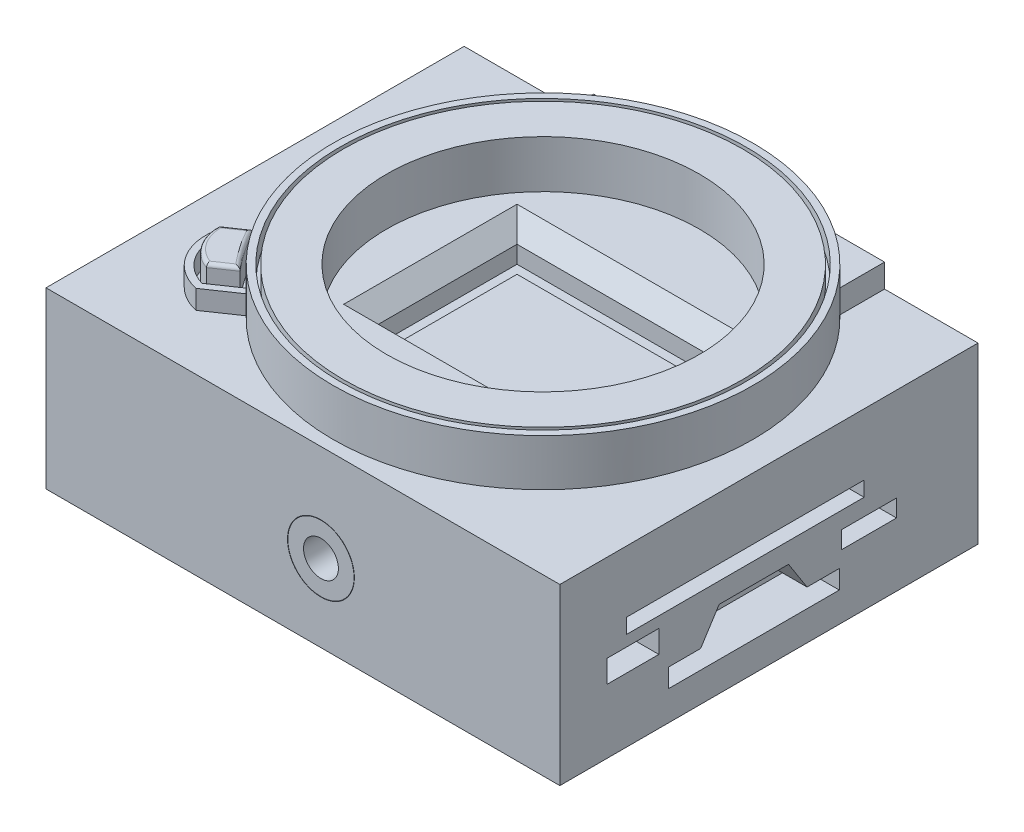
SolidWorks part; units mm, degrees
ref_plane "Front Plane" through (0, 0, 0) normal (0, 0, 1) x (1, 0, 0)
ref_plane "Top Plane" through (0, 0, 0) normal (0, 1, 0) x (1, 0, 0)
ref_plane "Right Plane" through (0, 0, 0) normal (1, 0, 0) x (0, 0, -1)
other "Center of Mass"
sketch "Sketch1" plane through (0, 0, 0) normal (0, 1, 0) x (1, 0, 0)
  line L1 (0, 0) -> (75.2856, 0)
  line L2 (0, 0) -> (0, 61.2648)
  line L3 (0, 61.2648) -> (75.2856, 61.2648)
  line L4 (75.2856, 0) -> (75.2856, 61.2648)
  dimension "D1" = 75.2856
  dimension "D2" = 61.2648
extrude "Boss-Extrude1" add sketch "Sketch1" along normal blind 25.527
sketch "Sketch2" plane through (0, 25.527, 0) normal (0, 1, 0) x (1, 0, 0)
  line L0 (0, 0) -> (75.2856, 0) construction
  line L1 (0, 61.2648) -> (0, 0) construction
  circle A0 centre (40.2844, 32.5374) radius 30.7594
  point P2 (40.2844, 1.778)
  point P3 (71.0438, 32.5374)
  point P6 (9.525, 32.5374)
  dimension "D1" = 61.5188
  dimension "D2" = 1.778
  dimension "D3" = 9.525
extrude "Boss-Extrude2" add sketch "Sketch2" along normal blind 6.858
sketch "Sketch3" plane through (0, 32.385, 0) normal (0, 1, 0) x (1, 0, 0)
  circle A0 centre (40.2844, 32.5374) radius 29.7594
  circle A2 centre (40.2844, 32.5374) radius 30.7594 construction
  point P7 (0, 0)
  point P8 (67.5841, 20.6906)
  point P9 (68.9615, 24.5846)
  dimension "D1" = 1
extrude "Cut-Extrude1" cut sketch "Sketch3" against normal blind 2.54
sketch "Sketch4" plane through (0, 29.845, 0) normal (0, 1, 0) x (1, 0, 0)
  circle A0 centre (40.2844, 32.5374) radius 29.2594
  circle A1 centre (40.2844, 32.5374) radius 22.9094
  circle A2 centre (40.2844, 32.5374) radius 29.7594 construction
  dimension "D1" = 6.35
  dimension "D2" = 0.5
extrude "Boss-Extrude3" add sketch "Sketch4" along normal up to surface (2.54 mm away)
sketch "Sketch5" plane through (0, 29.845, 0) normal (0, 1, 0) x (1, 0, 0)
  circle A0 centre (40.2844, 32.5374) radius 22.9094
extrude "Cut-Extrude2" cut sketch "Sketch5" against normal blind 12.7
sketch "Sketch6" plane through (0, 17.145, 0) normal (0, 1, 0) x (1, 0, 0)
  line L0 (40.2844, 41.4274) -> (40.2844, 23.6474) construction
  line L1 (27.5844, 41.4274) -> (52.9844, 41.4274)
  line L2 (27.5844, 41.4274) -> (27.5844, 23.6474)
  line L3 (27.5844, 23.6474) -> (52.9844, 23.6474)
  line L4 (52.9844, 41.4274) -> (52.9844, 23.6474)
  line L5 (27.5844, 32.5374) -> (40.2844, 32.5374) construction
  point P8 (40.2844, 32.5374)
  dimension "D1" = 17.78
  dimension "D2" = 25.4
extrude "Boss-Extrude4" add sketch "Sketch6" along normal blind 3.175
sketch "Sketch7" plane through (0, 25.527, 0) normal (0, -1, 0) x (1, 0, 0)
  line L1 (51.2788, -61.2648) -> (29.29, -61.2648)
  line L2 (51.2788, -61.2648) -> (29.29, -61.2648)
  arc A1 (29.29, -61.2648) -> (51.2788, -61.2648) centre (40.2844, -32.5374) ccw
  arc A2 (29.29, -61.2648) -> (51.2788, -61.2648) centre (40.2844, -32.5374) ccw
  dimension "D1" = 0
extrude "Boss-Extrude5" add sketch "Sketch7" along normal blind 7.62
sketch "Sketch8" plane through (0, 0, -61.2648) normal (0, 0, -1) x (-1, 0, 0)
  line L2 (-75.2856, 0) -> (0, 0) construction
  line L3 (-9.525, 32.385) -> (-71.0438, 32.385) construction
  line L4 (-66.6666, 32.385) -> (-66.6666, 0) construction
  line L5 (-40.2844, 18.5547) -> (-40.2844, 17.907) construction
  line L6 (-51.2788, 17.907) -> (-29.29, 17.907) construction
  circle A0 centre (-40.2844, 18.5547) radius 9.1821
  point P7 (-40.2844, 9.3726)
  dimension "D2" = 18.3642
  dimension "D1" = 9.3726
extrude "Cut-Extrude3" cut sketch "Sketch8" against normal blind 0.635 and the other way through all
sketch "Sketch9" plane through (0, 0, -60.6298) normal (0, 0, -1) x (-1, 0, 0)
  circle A0 centre (-40.2844, 18.5547) radius 8.3947
  dimension "D1" = 16.7894
extrude "Boss-Extrude6" add sketch "Sketch9" along normal blind 1.4478
fillet "Fillet1" radius 0.508 1 edges at (31.8897, 18.5547, -62.0776)
sketch "Sketch10" plane through (0, 0, -62.0776) normal (0, 0, -1) x (-1, 0, 0)
  circle A0 centre (-40.2844, 18.5547) radius 3.937
  circle A1 centre (-40.2844, 18.5547) radius 3.429
  dimension "D1" = 0.508
  dimension "D2" = 7.874
extrude "Cut-Extrude4" cut sketch "Sketch10" against normal blind 1.27
sketch "Sketch11" plane through (0, 25.527, 0) normal (0, 1, 0) x (1, 0, 0)
  line L0 (29.29, 61.2648) -> (0, 61.2648) construction
  line L1 (18.9738, 61.2648) -> (61.595, 61.2648)
  line L2 (18.9738, 61.2648) -> (18.9738, 54.7185)
  line L3 (18.9738, 54.7185) -> (61.595, 54.7185)
  line L4 (61.595, 61.2648) -> (61.595, 54.7185)
  line L5 (40.2844, 54.7185) -> (40.2844, 32.5374) construction
  arc A0 (29.29, 61.2648) -> (51.2788, 61.2648) centre (40.2844, 32.5374) ccw construction
  point P12 (0, 0)
  point P13 (0, 0)
  point P14 (66.0699, 49.3079)
  point P15 (0, 0)
  dimension "D1" = 42.6212
extrude "Boss-Extrude7" add sketch "Sketch11" along normal blind 3.429
sketch "Sketch12" plane through (0, 0, -61.2648) normal (0, 0, -1) x (-1, 0, 0)
  line L0 (-51.2788, 17.907) -> (-51.2788, 28.956) construction
  line L1 (-29.29, 17.907) -> (-29.29, 28.956) construction
  line L3 (-29.3633, 22.721) -> (-24.438, 22.721)
  line L4 (-24.438, 22.721) -> (-24.438, 5.7993)
  line L5 (-24.438, 5.7993) -> (-56.1308, 5.7993)
  line L6 (-56.1308, 5.7993) -> (-56.1308, 22.721)
  line L7 (-56.1308, 22.721) -> (-51.2055, 22.721)
  line L8 (-29.3633, 22.721) -> (-51.2055, 22.721) construction
  line L9 (-49.4436, 17.907) -> (-49.4436, 9.1261)
  line L10 (-49.4436, 9.1261) -> (-31.1252, 9.1261)
  line L11 (-31.1252, 9.1261) -> (-31.1252, 17.907)
  arc A0 (-51.2055, 22.721) -> (-49.4436, 17.907) centre (-40.2844, 23.9886) ccw
  arc A1 (-31.1252, 17.907) -> (-29.3633, 22.721) centre (-40.2844, 23.9886) ccw
  dimension "D1" = 16.9217
  dimension "D2" = 31.6928
  dimension "D3" = 3.3268
  dimension "D4" = 4.9253
extrude "Cut-Extrude5" cut sketch "Sketch12" along normal through all
sketch "Sketch13" plane through (0, 25.527, 0) normal (0, 1, 0) x (1, 0, 0)
  line L0 (18.2184, 11.1076) -> (13.8576, 8.128)
  line L1 (13.8576, 8.128) -> (7.9395, 16.7894) construction
  line L2 (7.9395, 16.7894) -> (12.3003, 19.769)
  line L3 (12.5332, 6.3384) -> (8.0299, 12.9292) construction
  line L4 (12.0366, 19.3565) -> (21.5196, 5.4777) construction
  line L5 (0, 0) -> (75.2856, 0) construction
  arc A0 (18.9738, 54.7185) -> (61.595, 54.7185) centre (40.2844, 32.5374) ccw construction
  arc A1 (7.9395, 16.7894) -> (13.8576, 8.128) centre (15.4306, 15.5553) ccw
  arc A2 (12.3003, 19.769) -> (18.2184, 11.1076) centre (40.2844, 32.5374) ccw
  point P13 (21.3552, 8.2923)
  point P17 (8.0732, 16.5534)
  point P18 (0, 0)
  dimension "D1" = 10.4902
  dimension "D2" = 6.9342
  dimension "D3" = 8.128
  dimension "D4" = 16.7894
extrude "Boss-Extrude8" add sketch "Sketch13" along normal blind 2.794
sketch "Sketch14" plane through (0, 28.321, 0) normal (0, 1, 0) x (1, 0, 0)
  line L2 (16.692, 11.2758) -> (17.5254, 11.8452)
  line L3 (11.9021, 18.2858) -> (12.7355, 18.8553)
  line L4 (11.9021, 18.2858) -> (8.8716, 16.2152)
  line L5 (13.6615, 9.2051) -> (16.692, 11.2758)
  line L6 (11.9021, 18.2858) -> (8.8716, 16.2152)
  line L7 (13.6615, 9.2051) -> (16.692, 11.2758)
  arc A2 (12.3003, 19.769) -> (18.2184, 11.1076) centre (40.2844, 32.5374) ccw construction
  arc A3 (12.7355, 18.8553) -> (17.5254, 11.8452) centre (40.2844, 32.5374) ccw
  arc A4 (11.9021, 18.2858) -> (16.692, 11.2758) centre (40.2844, 32.5374) ccw
  arc A5 (8.8716, 16.2152) -> (13.6615, 9.2051) centre (15.4306, 15.5553) ccw
  arc A6 (11.9021, 18.2858) -> (16.692, 11.2758) centre (40.2844, 32.5374) ccw construction
  arc A7 (8.8716, 16.2152) -> (13.6615, 9.2051) centre (15.4306, 15.5553) ccw
  point P0 (0, 0)
  dimension "D1" = 1
extrude "Cut-Extrude6" cut sketch "Sketch14" against normal up to surface (2.794 mm away)
sketch "Sketch15" plane through (0, 25.527, 0) normal (0, 1, 0) x (1, 0, 0)
  line L5 (13.5448, 9.9732) -> (17.1304, 12.4232)
  line L6 (13.1304, 18.2773) -> (9.5448, 15.8273)
  line L7 (13.5448, 9.9732) -> (17.0567, 12.3728)
  line L8 (13.0567, 18.2269) -> (9.5448, 15.8273)
  arc A3 (12.7355, 18.8553) -> (17.5254, 11.8452) centre (40.2844, 32.5374) ccw construction
  arc A4 (9.5448, 15.8273) -> (13.5448, 9.9732) centre (15.4306, 15.5553) ccw
  arc A5 (9.5448, 15.8273) -> (13.5448, 9.9732) centre (15.4306, 15.5553) ccw
  arc A6 (13.0567, 18.2269) -> (17.0567, 12.3728) centre (40.2844, 32.5374) ccw
  dimension "D1" = 0.7
extrude "Boss-Extrude9" add sketch "Sketch15" along normal blind 4.8514 contours L8 A5 L7 A6
sketch "Sketch18" plane through (0, 30.3784, 0) normal (0, 1, 0) x (1, 0, 0)
  line L2 (13.0567, 18.2269) -> (9.5448, 15.8273)
  line L3 (13.5448, 9.9732) -> (17.0567, 12.3728)
  line L4 (13.0567, 18.2269) -> (12.4749, 17.8294)
  line L5 (16.4749, 11.9753) -> (17.0567, 12.3728)
  arc A0 (12.4749, 17.8294) -> (16.4749, 11.9753) centre (40.2844, 32.5374) ccw
  arc A1 (12.437, 17.9012) -> (16.5281, 11.9139) centre (40.2844, 32.5374) ccw construction
  arc A2 (13.0567, 18.2269) -> (17.0567, 12.3728) centre (40.2844, 32.5374) ccw
  arc A3 (9.5448, 15.8273) -> (13.5448, 9.9732) centre (15.4306, 15.5553) ccw
  arc A4 (13.0567, 18.2269) -> (17.0567, 12.3728) centre (40.2844, 32.5374) ccw
  dimension "D1" = 0
  dimension "D2" = 0.7
extrude "Cut-Extrude7" cut sketch "Sketch18" against normal blind 4.064
fillet "Fillet5" radius 0.508 4 edges at (15.0099, 30.3784, -10.9742) (10.5657, 30.3784, -12.2313) (11.0099, 30.3784, -16.8284) (14.3094, 30.3784, -14.7893)
sketch "Sketch19" plane through (0, 28.956, 0) normal (0, 1, 0) x (1, 0, 0)
  line L1 (34.5536, 54.7185) -> (46.0152, 54.7185)
  line L2 (34.5536, 54.7185) -> (46.0152, 54.7185)
  arc A1 (46.0152, 54.7185) -> (34.5536, 54.7185) centre (40.2844, 32.5374) ccw
  arc A2 (46.0152, 54.7185) -> (34.5536, 54.7185) centre (40.2844, 32.5374) ccw
  dimension "D1" = 0
extrude "Cut-Extrude8" cut sketch "Sketch19" against normal up to vertex
sketch "Sketch20" plane through (0, 0, -61.2648) normal (0, 0, -1) x (-1, 0, 0)
  line L0 (-24.6634, 10.668) -> (-24.6634, 22.733) construction
  line L1 (0, 25.527) -> (0, 0) construction
  line L2 (-29.29, 28.956) -> (-18.9738, 28.956) construction
  line L3 (-24.6634, 10.668) -> (-55.8546, 10.668) construction
  line L4 (-75.2856, 25.527) -> (-75.2856, 0) construction
  circle A0 centre (-24.6634, 22.733) radius 3.175
  circle A1 centre (-24.6634, 10.668) radius 3.175
  circle A2 centre (-55.8546, 10.668) radius 3.175
  circle A3 centre (-55.8546, 10.668) radius 3.1242
  circle A4 centre (-24.6634, 10.668) radius 3.1242
  circle A5 centre (-24.6634, 22.733) radius 3.1242
  point P5 (-21.4884, 22.733)
  point P8 (-24.6634, 25.908)
  point P12 (-59.0296, 10.668)
  dimension "D1" = 6.35
  dimension "D2" = 21.4884
  dimension "D3" = 12.065
  dimension "D4" = 3.048
  dimension "D5" = 16.256
  dimension "D6" = 0.0508
extrude "Cut-Extrude9" cut sketch "Sketch20" against normal blind 4.064
sketch "Sketch21" plane through (75.2856, 0, 0) normal (1, 0, 0) x (0, 0, -1)
  line L0 (15.9004, 4.3434) -> (40.9448, 4.3434)
  line L1 (40.9448, 4.3434) -> (40.9448, 7.0866)
  line L2 (40.9448, 7.0866) -> (36.2204, 7.0866)
  line L3 (36.2204, 7.0866) -> (33.5026, 11.3284)
  line L4 (33.5026, 11.3284) -> (23.3426, 11.3284)
  line L5 (23.3426, 11.3284) -> (20.6248, 7.0866)
  line L6 (20.6248, 7.0866) -> (15.9004, 7.0866)
  line L7 (15.9004, 7.0866) -> (15.9004, 4.3434)
  line L8 (28.4226, 11.3284) -> (28.4226, 4.3434) construction
  line L9 (61.2648, 25.527) -> (61.2648, 0) construction
  line L11 (0, 0) -> (61.2648, 0) construction
  point P12 (34.0658, 12.2555)
  dimension "D1" = 2.7432
  dimension "D2" = 25.0444
  dimension "D3" = 6.985
  dimension "D4" = 20.32
  dimension "D5" = 4.3434
  dimension "D6" = 4.7244
  dimension "D7" = 10.16
extrude "Cut-Extrude10" cut sketch "Sketch21" against normal blind 6.35
sketch "Sketch22" plane through (75.2856, 0, 0) normal (1, 0, 0) x (0, 0, -1)
  line L0 (0, 0) -> (61.2648, 0) construction
  line L1 (9.779, 16.4846) -> (44.577, 16.4846)
  line L2 (9.779, 16.4846) -> (9.779, 14.3002)
  line L3 (9.779, 14.3002) -> (44.577, 14.3002)
  line L4 (44.577, 16.4846) -> (44.577, 14.3002)
  line L5 (61.2648, 25.527) -> (61.2648, 0) construction
  dimension "D1" = 2.1844
  dimension "D2" = 34.798
  dimension "D3" = 14.3002
  dimension "D4" = 16.6878
extrude "Cut-Extrude11" cut sketch "Sketch22" against normal blind 6.35
sketch "Sketch23" plane through (75.2856, 0, 0) normal (1, 0, 0) x (0, 0, -1)
  line L0 (0, 0) -> (61.2648, 0) construction
  line L1 (41.275, 11.8364) -> (49.3268, 11.8364)
  line L2 (41.275, 11.8364) -> (41.275, 9.2964)
  line L3 (41.275, 9.2964) -> (49.3268, 9.2964)
  line L4 (49.3268, 11.8364) -> (49.3268, 9.2964)
  line L5 (61.2648, 25.527) -> (61.2648, 0) construction
  dimension "D1" = 8.0518
  dimension "D2" = 2.54
  dimension "D3" = 9.2964
  dimension "D4" = 11.938
extrude "Cut-Extrude12" cut sketch "Sketch23" against normal blind 6.35
sketch "Sketch24" plane through (75.2856, 0, 0) normal (1, 0, 0) x (0, 0, -1)
  line L0 (0, 0) -> (61.2648, 0) construction
  line L1 (6.8834, 12.7) -> (14.5034, 12.7)
  line L2 (6.8834, 12.7) -> (6.8834, 9.398)
  line L3 (6.8834, 9.398) -> (14.5034, 9.398)
  line L4 (14.5034, 12.7) -> (14.5034, 9.398)
  line L5 (0, 25.527) -> (0, 0) construction
  dimension "D1" = 3.302
  dimension "D2" = 7.62
  dimension "D3" = 9.398
  dimension "D4" = 6.8834
extrude "Cut-Extrude13" cut sketch "Sketch24" against normal blind 6.35 contours L4 L3 L2 L1
sketch "Sketch25" plane through (0, 0, 0) normal (0, 0, 1) x (1, 0, 0)
  line L0 (75.2856, 25.527) -> (75.2856, 0) construction
  line L1 (40.2844, 11.3284) -> (40.2844, 32.385) construction
  line L2 (63.1938, 32.385) -> (17.375, 32.385) construction
  line L3 (0, 25.527) -> (75.2856, 25.527) construction
  circle A0 centre (40.2844, 11.3284) radius 4.9022
  circle A1 centre (40.2844, 11.3284) radius 4.8514
  point P2 (45.1866, 11.3284)
  point P3 (75.2856, 12.7635)
  point P10 (40.2844, 16.2306)
  dimension "D1" = 9.8044
  dimension "D2" = 9.2964
  dimension "D3" = 0.0508
extrude "Cut-Extrude14" cut sketch "Sketch25" against normal blind 6.35
hole_wizard "1/4-20 Tapped Hole1" positions "Sketch26" profile "Sketch27" tap size "1/4-20" standard "ANSI Inch"
sketch "Sketch26" plane through (0, 0, 0) normal (0, 0, 1) x (1, 0, 0)
  point P0 (40.2844, 11.3284)
sketch "Sketch27" plane through (40.2844, 11.3284, 0) normal (1, 0, 0) x (0, -1, 0)
  line L0 (0, 0) -> (0, 7.8838)
  line L1 (0, 7.8838) -> (2.5527, 6.35)
  line L2 (2.5527, 6.35) -> (2.5527, 0)
  line L5 (2.5527, 0) -> (0, 0)
  line L10 (0, 7.8838) -> (-2.5527, 6.35) construction
  line L11 (0, -6.35) -> (0, 107.95) construction
  dimension "Tap Drill Dia." = 5.1054
  dimension "Tap Drill Depth" = 6.35
  dimension "Drill Angle" = 118
sketch "Sketch28" plane through (0, 20.32, 0) normal (0, 1, 0) x (1, 0, 0)
  line L0 (27.5844, 41.4274) -> (27.5844, 23.6474) construction
  line L1 (26.3144, 42.6974) -> (54.2544, 42.6974)
  line L2 (26.3144, 42.6974) -> (26.3144, 22.3774)
  line L3 (26.3144, 22.3774) -> (54.2544, 22.3774)
  line L4 (54.2544, 42.6974) -> (54.2544, 22.3774)
  line L5 (27.5844, 23.6474) -> (52.9844, 23.6474) construction
  line L6 (52.9844, 23.6474) -> (52.9844, 41.4274) construction
  line L7 (52.9844, 41.4274) -> (27.5844, 41.4274) construction
  circle A0 centre (40.2844, 32.5374) radius 22.9094
  circle A1 centre (40.2844, 32.5374) radius 22.9094 construction
  dimension "D1" = 1.27
  dimension "D2" = 1.27
  dimension "D3" = 1.27
  dimension "D4" = 1.27
extrude "Boss-Extrude10" add sketch "Sketch28" along normal blind 5.08
chamfer "Chamfer1" distance 2.54 angle 45 4 edges at (26.3144, 25.4, -32.5374) (40.2844, 25.4, -22.3774) (54.2544, 25.4, -32.5374) (40.2844, 25.4, -42.6974)
